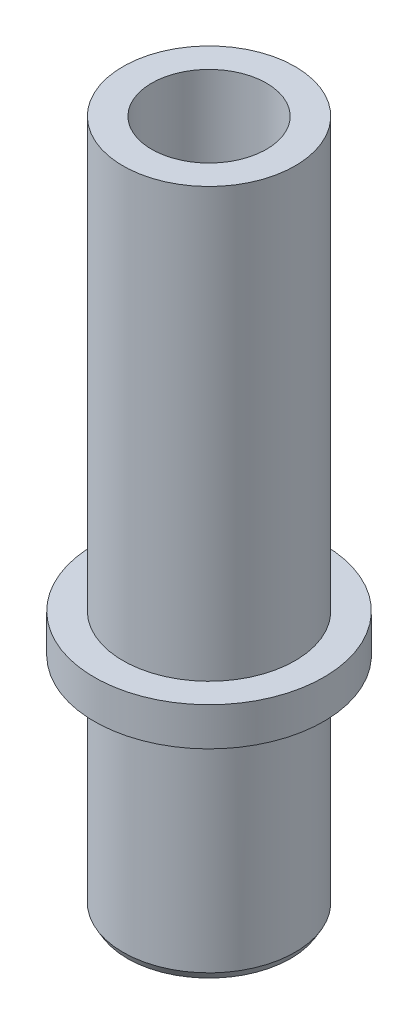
SolidWorks part; units mm, degrees
ref_plane "Frontal" through (0, 0, 0) normal (0, 0, 1) x (1, 0, 0)
ref_plane "Horizontal" through (0, 0, 0) normal (0, 1, 0) x (1, 0, 0)
ref_plane "Vertical" through (0, 0, 0) normal (1, 0, 0) x (0, 0, -1)
imported_body "Importée1"
sketch "Esquisse1" plane through (0, 0, 0) normal (0, 0, 1) x (1, 0, 0)
  line L0 (0, 0) -> (0, 200) construction
  line L1 (16.1547, 200) -> (-16.1547, 200) construction
  line L2 (22.5, 68) -> (22.5, 200) construction
  line L3 (0, 200) -> (22.5, 200)
  line L4 (0, 200) -> (0, 180)
  line L5 (0, 180) -> (22.5, 180)
  line L6 (22.5, 200) -> (22.5, 180)
  dimension "D1" = 20
revolve "Enlèvement de matière-Révolution1" cut sketch "Esquisse1" angle 360 about L0
